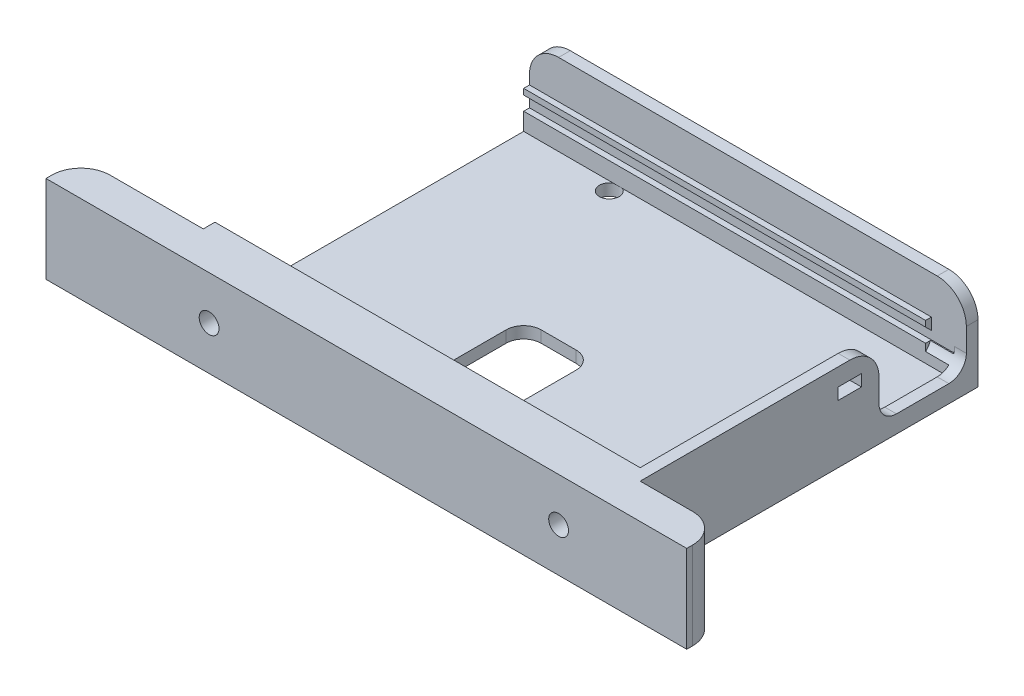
SolidWorks part; units mm, degrees
ref_plane "Alzado" through (0, 0, 0) normal (0, 0, 1) x (1, 0, 0)
ref_plane "Planta" through (0, 0, 0) normal (0, 1, 0) x (1, 0, 0)
ref_plane "Vista lateral" through (0, 0, 0) normal (1, 0, 0) x (0, 0, -1)
sketch "Croquis1" plane through (0, 0, 0) normal (0, 1, 0) x (1, 0, 0)
  line L1 (0, 0) -> (75, 0)
  line L2 (0, 0) -> (0, 58)
  line L3 (0, 58) -> (75, 58)
  line L4 (75, 0) -> (75, 58)
  dimension "D1" = 75
  dimension "D2" = 58
extrude "Saliente-Extruir1" add sketch "Croquis1" along normal blind 15
sketch "Croquis2" plane through (0, 15, 0) normal (0, 1, 0) x (1, 0, 0)
  line L0 (75, 58) -> (0, 58) construction
  line L1 (2, 56) -> (73, 56)
  line L2 (2, 56) -> (2, 2)
  line L3 (2, 2) -> (73, 2)
  line L4 (73, 56) -> (73, 2)
  line L5 (2, 56) -> (73, 2) construction
  line L6 (2, 2) -> (73, 56) construction
  line L7 (0, 58) -> (0, 0) construction
  line L8 (75, 0) -> (75, 58) construction
  line L9 (0, 0) -> (75, 0) construction
  point P0 (37.5, 29)
  dimension "D1" = 2
  dimension "D2" = 2
  dimension "D3" = 2
  dimension "D4" = 2
extrude "Cortar-Extruir1" cut sketch "Croquis2" against normal blind 13
sketch "Croquis4" plane through (0, 0, 0) normal (-1, 0, 0) x (0, 0, 1)
  line L0 (-58, 15) -> (0, 15) construction
  line L1 (-56, 15) -> (-2, 15)
  line L2 (-56, 15) -> (-56, 2)
  line L3 (-56, 2) -> (-2, 2)
  line L4 (-2, 15) -> (-2, 2)
  line L5 (-58, 0) -> (0, 0) construction
  line L6 (0, 15) -> (0, 0) construction
  line L7 (-58, 15) -> (-58, 0) construction
  dimension "D1" = 0
  dimension "D2" = 2
  dimension "D3" = 2
  dimension "D4" = 2
extrude "Cortar-Extruir3" cut sketch "Croquis4" against normal up to next
sketch "Croquis5" plane through (0, 0, 0) normal (-1, 0, 0) x (0, 0, 1)
  line L0 (-56, 15) -> (-56, 2) construction
  line L1 (-56, 2) -> (-55, 2)
  line L2 (-56, 2) -> (-56, 5)
  line L3 (-56, 5) -> (-55, 5)
  line L4 (-55, 2) -> (-55, 5)
  line L5 (-29, 0) -> (-29, 17.9539) construction
  line L6 (-56, 6.4) -> (-56, 8.4)
  line L7 (-56, 8.4) -> (-55, 8.4)
  line L8 (-55, 7.4) -> (-55, 8.4)
  line L9 (-58, 0) -> (0, 0) construction
  line L11 (-2, 6.4) -> (-3, 7.4)
  line L12 (-3, 7.4) -> (-3, 8.4)
  line L13 (-2, 8.4) -> (-3, 8.4)
  line L14 (-2, 6.4) -> (-2, 8.4)
  line L15 (-3, 2) -> (-3, 5)
  line L16 (-2, 5) -> (-3, 5)
  line L17 (-2, 2) -> (-2, 5)
  line L18 (-2, 2) -> (-3, 2)
  line L19 (-56, 6.4) -> (-55, 7.4)
  dimension "D1" = 1
  dimension "D2" = 3
  dimension "D3" = 1
  dimension "D4" = 2
  dimension "D5" = 1
  dimension "D6" = 1.4
  dimension "D7" = 1
extrude "Ranura" add sketch "Croquis5" against normal up to next
sketch "Croquis6" plane through (0, 0, 0) normal (0, -1, 0) x (1, 0, 0)
  line L0 (0, -58) -> (0, 0) construction
  line L1 (31, -7) -> (37, -7)
  line L2 (28, -10) -> (28, -24)
  line L3 (31, -27) -> (37, -27)
  line L4 (40, -10) -> (40, -24)
  line L5 (0, 0) -> (75, 0) construction
  arc A0 (40, -10) -> (37, -7) centre (37, -10) ccw
  arc A1 (31, -7) -> (28, -10) centre (31, -10) ccw
  arc A2 (40, -24) -> (37, -27) centre (37, -24) cw
  arc A3 (28, -24) -> (31, -27) centre (31, -24) ccw
  dimension "D5" = 3
  dimension "D1" = 28
  dimension "D2" = 40
  dimension "D3" = 20
  dimension "D4" = 7
extrude "Cortar-Extruir4" cut sketch "Croquis6" against normal up to next
sketch "Croquis7" plane through (0, 0, -2) normal (0, 0, -1) x (-1, 0, 0)
  line L1 (-73, 5) -> (-72, 5)
  line L2 (-73, 5) -> (-73, 2)
  line L3 (-72, 5) -> (-72, 2)
  line L4 (-73, 2) -> (0, 2) construction
  line L6 (-73, 8.4) -> (-72, 8.4)
  line L7 (-73, 8.4) -> (-73, 6.4)
  line L8 (-73, 8.4) -> (0, 8.4) construction
  line L9 (-72, 8.4) -> (-72, 6.4)
  line L11 (-73, 6.4) -> (-72, 6.4)
  line L12 (-72, 2) -> (-73, 2)
  line L13 (-75, 15) -> (-75, 0) construction
  dimension "D1" = 1
  dimension "D2" = 1
  dimension "D3" = 0
  dimension "D4" = 2
  dimension "D5" = 3
  dimension "D6" = 1.4
  dimension "D7" = 2
  dimension "D8" = 2
sketch "Croquis3" plane through (75, 0, 0) normal (1, 0, 0) x (0, 0, -1)
  line L0 (58, 15) -> (58, 0) construction
  line L1 (41, 15) -> (56, 15)
  line L2 (41, 15) -> (41, 6)
  line L3 (44, 3) -> (53, 3)
  line L4 (56, 15) -> (56, 6)
  line L5 (0, 0) -> (58, 0) construction
  line L6 (0, 15) -> (58, 15) construction
  arc A0 (56, 6) -> (53, 3) centre (53, 6) cw
  arc A1 (41, 6) -> (44, 3) centre (44, 6) ccw
  dimension "D5" = 3
  dimension "D1" = 15
  dimension "D2" = 2
  dimension "D3" = 3
  dimension "D4" = 0
extrude "Cortar-Extruir5" cut sketch "Croquis3" against normal blind 6
sketch "Croquis17" plane through (75, 0, 0) normal (1, 0, 0) x (0, 0, -1)
  line L0 (0, 15) -> (41, 15) construction
  line L1 (38, 12) -> (34, 12)
  line L2 (38, 12) -> (38, 10)
  line L3 (38, 10) -> (34, 10)
  line L4 (34, 12) -> (34, 10)
  line L5 (41, 15) -> (41, 6) construction
  dimension "D1" = 2
  dimension "D2" = 4
  dimension "D3" = 3
  dimension "D4" = 3
extrude "Cortar-Extruir8" cut sketch "Croquis17" against normal up to next
fillet "Redondeo1" radius 5 3 edges at (74, 15, -41) (75, 15, -57) (0, 15, -57)
sketch "Croquis18" plane through (0, 0, 0) normal (0, 0, 1) x (1, 0, 0)
  line L0 (75, 15) -> (75, 0) construction
  line L1 (-21, 15) -> (89, 15)
  line L2 (-21, 15) -> (-21, 0)
  line L3 (-21, 0) -> (89, 0)
  line L4 (89, 15) -> (89, 0)
  line L5 (0, 0) -> (75, 0) construction
  dimension "D1" = 110
  dimension "D2" = 14
  dimension "D3" = 15
  dimension "D4" = 0
extrude "Saliente-Extruir4" add sketch "Croquis18" along normal blind 6
extrude "Saliente-Extruir11" add sketch "Croquis7" along normal blind 39
hole_wizard "Taladro de margen para M31" positions "Croquis21" profile "Croquis22" hole size "M3" standard "ISO"
sketch "Croquis21" plane through (0, 0, 6) normal (0, 0, 1) x (1, 0, 0)
  line L0 (89, 0) -> (89, 15) construction
  line L1 (-21, 0) -> (89, 0) construction
  point P13 (7, 7.5)
  point P15 (67, 7.5)
  dimension "D1" = 60
  dimension "D2" = 22
  dimension "D3" = 7.5
sketch "Croquis22" plane through (7, 7.5, 6) normal (1, 0, 0) x (0, -1, 0)
  line L0 (0, 0) -> (0, 5.0215)
  line L1 (0, 5.0215) -> (1.7, 4)
  line L2 (1.7, 4) -> (1.7, 0)
  line L5 (1.7, 0) -> (0, 0)
  line L10 (0, 5.0215) -> (-1.7, 4) construction
  line L11 (0, -6.35) -> (0, 107.95) construction
  dimension "Diámetro de taladro" = 3.4
  dimension "Profundidad de taladro" = 4
  dimension "Ángulo de perforador" = 118
hole_wizard "Taladro de margen para M32" positions "Croquis24" profile "Croquis23" hole size "M3" standard "ISO"
sketch "Croquis24" plane through (0, 2, 0) normal (0, 1, 0) x (1, 0, 0)
  line L0 (70, 58) -> (5, 58) construction
  line L1 (0, 55) -> (0, 3) construction
  point P0 (16.2, 53.5)
  dimension "D1" = 4.5
  dimension "D2" = 16.2
sketch "Croquis23" plane through (16.2, 2, -53.5) normal (1, 0, 0) x (0, 0, 1)
  line L0 (0, 0) -> (0, 5.0215)
  line L1 (0, 5.0215) -> (1.7, 4)
  line L2 (1.7, 4) -> (1.7, 0)
  line L5 (1.7, 0) -> (0, 0)
  line L10 (0, 5.0215) -> (-1.7, 4) construction
  line L11 (0, -6.35) -> (0, 107.95) construction
  dimension "Diámetro de taladro" = 3.4
  dimension "Profundidad de taladro" = 4
  dimension "Ángulo de perforador" = 118
fillet "Redondeo2" radius 5 2 edges at (-21, 7.5, 0) (89, 7.5, 0)
